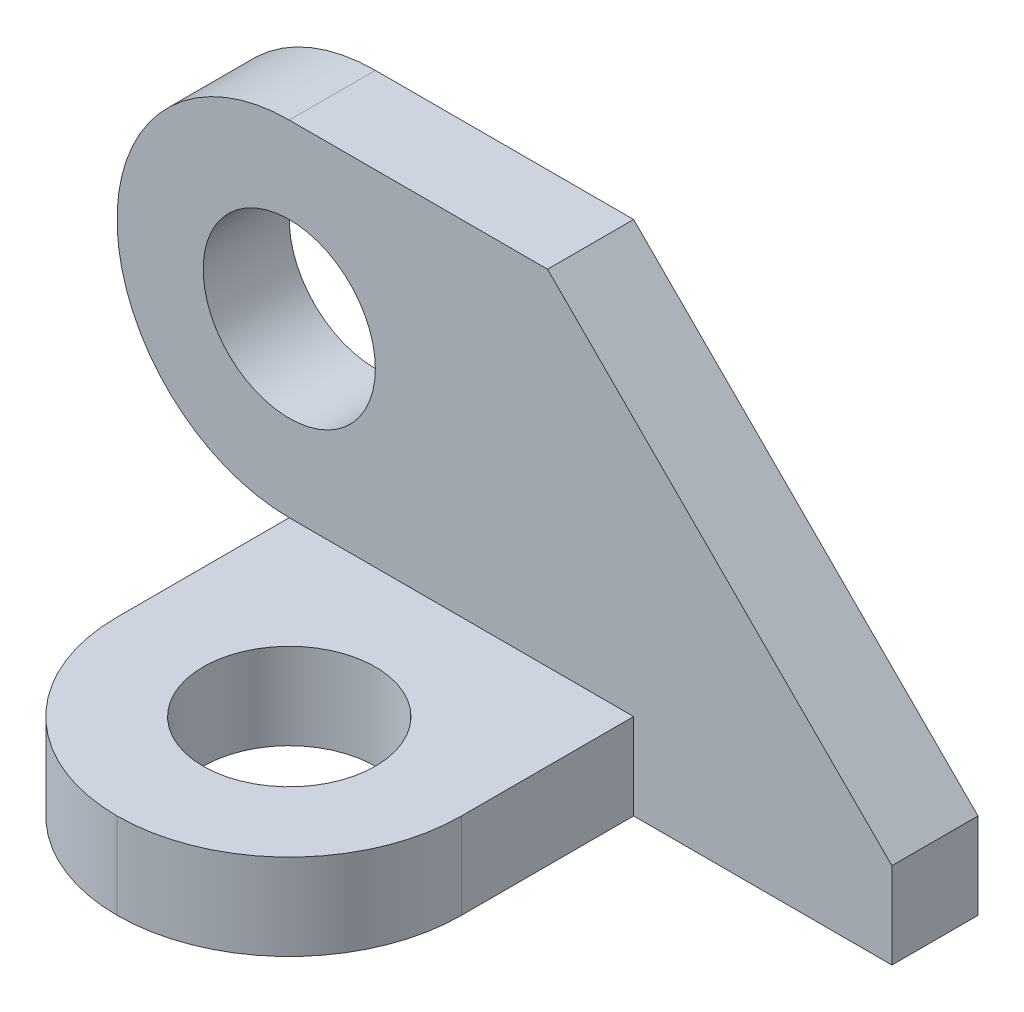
SolidWorks part; units mm, degrees
ref_plane "Front Plane" through (0, 0, 0) normal (0, 0, 1) x (1, 0, 0)
ref_plane "Top Plane" through (0, 0, 0) normal (0, 1, 0) x (1, 0, 0)
ref_plane "Right Plane" through (0, 0, 0) normal (1, 0, 0) x (0, 0, -1)
sketch "Sketch1" plane through (0, 0, 0) normal (0, 0, 1) x (1, 0, 0)
  line L0 (0, 0) -> (0, 10)
  line L1 (0, 50) -> (30, 50)
  line L2 (30, 50) -> (70, 10)
  line L3 (70, 10) -> (70, 0)
  line L4 (70, 0) -> (0, 0)
  arc A0 (0, 10) -> (0, 50) centre (0, 30) cw
  dimension "D3" = 40
  dimension "D1" = 70
  dimension "D2" = 10
  dimension "D4" = 30
extrude "Extrude1" add sketch "Sketch1" against normal blind 10
sketch "Sketch2" plane through (0, 0, 0) normal (0, 1, 0) x (1, 0, 0)
  line L1 (0, 0) -> (40, 0)
  line L2 (0, 0) -> (0, -40)
  line L3 (0, -40) -> (40, -40)
  line L4 (40, 0) -> (40, -40)
  dimension "D1" = 40
  dimension "D2" = 40
extrude "Extrude2" add sketch "Sketch2" along normal blind 10
fillet "Fillet1" radius 20 2 edges at (40, 5, 40) (0, 5, 40)
sketch "Sketch3" plane through (0, 10, 0) normal (0, 1, 0) x (1, 0, 0)
  circle A0 centre (20, -20) radius 10
  arc A1 (0, -20) -> (20, -40) centre (20, -20) ccw construction
  dimension "D1" = 20
extrude "Extrude3" cut sketch "Sketch3" against normal blind 10
sketch "Sketch4" plane through (0, 0, 0) normal (0, 0, 1) x (1, 0, 0)
  circle A0 centre (0, 30) radius 10
  dimension "D1" = 20
extrude "Extrude4" cut sketch "Sketch4" against normal blind 10
